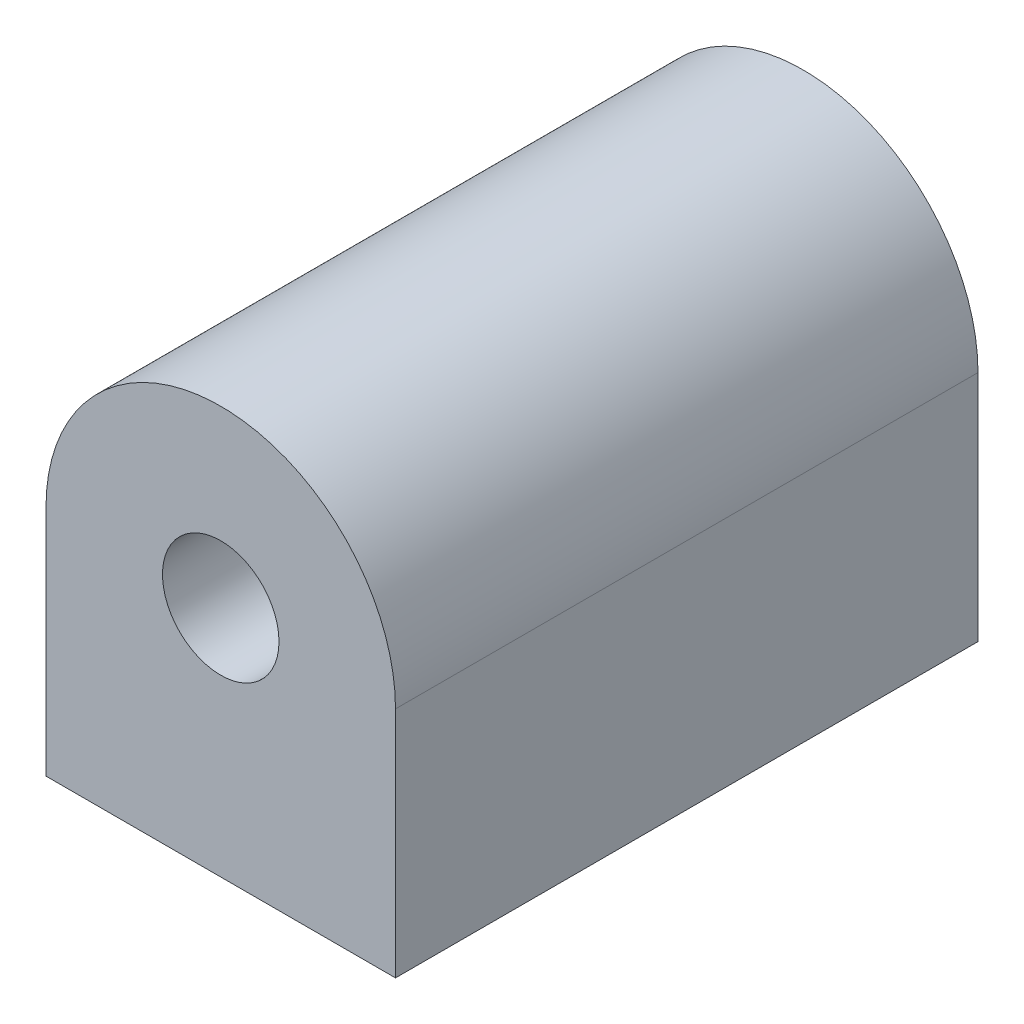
SolidWorks part; units mm, degrees
ref_plane "Front Plane" through (0, 0, 0) normal (0, 0, 1) x (1, 0, 0)
ref_plane "Top Plane" through (0, 0, 0) normal (0, 1, 0) x (1, 0, 0)
ref_plane "Right Plane" through (0, 0, 0) normal (1, 0, 0) x (0, 0, -1)
sketch "Sketch1" plane through (0, 0, 0) normal (0, 0, 1) x (1, 0, 0)
  line L2 (-15, 0) -> (-15, -20)
  line L3 (-15, -20) -> (15, -20)
  line L4 (15, 0) -> (15, -20)
  arc A0 (15, 0) -> (-15, 0) centre (0, 0) ccw
  dimension "D1" = 30
  dimension "D2" = 20
extrude "Boss-Extrude1" add sketch "Sketch1" along normal mid plane 50
sketch "Sketch2" plane through (0, 0, 25) normal (0, 0, 1) x (1, 0, 0)
  circle A0 centre (0, 0) radius 5
  dimension "D1" = 10
extrude "Cut-Extrude1" cut sketch "Sketch2" against normal through all
sketch "Sketch3" plane through (0, -20, 0) normal (0, -1, 0) x (1, 0, 0)
  line L0 (15, 12.5) -> (0, 12.5)
  line L1 (15, 25) -> (15, -25) construction
  line L2 (0, 12.5) -> (0, 0) construction
  line L3 (0, 0) -> (20.998, 0) construction
  dimension "D1" = 25
sketch "Sketch4" plane through (0, -20, 0) normal (0, -1, 0) x (1, 0, 0)
  line L0 (0, 0) -> (20.998, 0) construction
  line L1 (0, 0) -> (20.998, 0) construction
  line L2 (15, 12.5) -> (0, 12.5) construction
  line L3 (15, 12.5) -> (0, 12.5) construction
  line L5 (15, -12.5) -> (0, -12.5)
  line L6 (0, 0) -> (0, -12.5) construction
